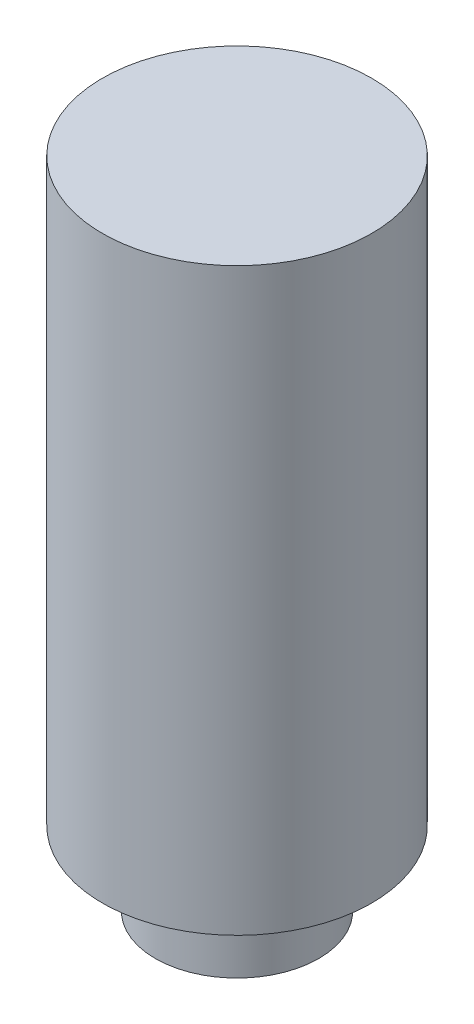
SolidWorks part; units mm, degrees
ref_plane "Front Plane" through (0, 0, 0) normal (0, 0, 1) x (1, 0, 0)
ref_plane "Top Plane" through (0, 0, 0) normal (0, 1, 0) x (1, 0, 0)
ref_plane "Right Plane" through (0, 0, 0) normal (1, 0, 0) x (0, 0, -1)
sketch "Sketch2" plane through (0, 0, 0) normal (1, 0, 0) x (0, 0, -1)
  line L0 (0, 0) -> (0, 84.6369) construction
  line L1 (2.2987, 11.176) -> (2.2987, 1.27)
  line L2 (0, 0) -> (1.397, 0)
  line L3 (1.397, 0) -> (1.397, 0.762)
  line L4 (1.397, 0.762) -> (1.27, 0.762)
  line L5 (1.27, 0.762) -> (1.27, 1.27)
  line L8 (2.2987, 1.27) -> (1.27, 1.27)
  line L9 (2.2987, 11.176) -> (0, 11.176)
  line L10 (0, 11.176) -> (0, 0)
  dimension "D1" = 4.5974
  dimension "D2" = 2.794
  dimension "D3" = 0.762
  dimension "D4" = 0.508
  dimension "D5" = 2.54
  dimension "D6" = 9.906
revolve "Revolve1" add sketch "Sketch2" angle 360 about L0
